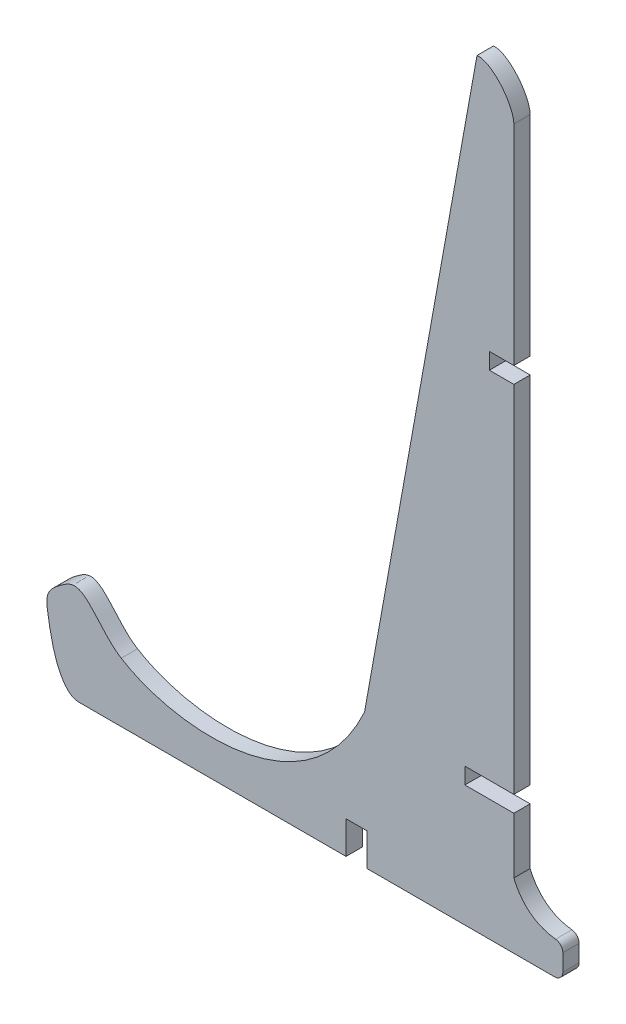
SolidWorks part; units mm, degrees
ref_plane "Plan de face" through (0, 0, 0) normal (0, 0, 1) x (1, 0, 0)
ref_plane "Plan de dessus" through (0, 0, 0) normal (0, 1, 0) x (1, 0, 0)
ref_plane "Plan de droite" through (0, 0, 0) normal (1, 0, 0) x (0, 0, -1)
sketch "Esquisse1" plane through (0, 0, 0) normal (0, 0, 1) x (1, 0, 0)
  line L0 (-5, 0) -> (-296.0946, 0)
  line L1 (-30, 40) -> (-30, 440)
  line L3 (0, 15.3047) -> (0, 5)
  line L6 (-121.4743, 82.2555) -> (-52.5746, 465.09)
  arc A0 (-296.0946, 0) -> (-303.118, 2.8816) centre (-296.0946, 10) cw
  arc A1 (-5, 0) -> (0, 5) centre (-5, 5) ccw
  arc A2 (-4.4219, 20.2711) -> (0, 15.3047) centre (-5, 15.3047) cw
  spline S0 degree 3 poles (-303.118, 2.8816) (-308.5789, 8.2696) (-312.4251, 20.4823) (-317.1679, 46.009) (-316.7603, 50.559) (-293.0095, 66.3483) (-282.4278, 43.3712) (-270.5103, 36.343) knots 0.041545 0.041545 0.041545 0.041545 0.264607 0.330646 0.660674 0.731734 1 1 1 1
  spline S1 degree 3 poles (-270.5103, 36.343) (-237.1219, 15.1792) (-155.3142, 8.3218) (-121.4743, 82.2555) knots 0 0 0 0 1 1 1 1
  spline S2 degree 3 poles (-52.5746, 465.09) (-43.2967, 466.2795) (-30.2, 449.9) (-30, 440) knots 0 0 0 0 1 1 1 1
  spline S3 degree 3 poles (-4.4219, 20.2711) (-16.2475, 21.6476) (-25.2007, 28.4801) (-30, 40) knots 0.107609 0.107609 0.107609 0.107609 1 1 1 1
  point P5 (-21.062, 27.4419)
  point P6 (-17.0408, 24.426)
  point P24 (0, 0)
  dimension "D2" = 10
  dimension "D5" = 5
  dimension "D1" = 5
  dimension "D3" = 30
extrude "Boss.-Extru.1" add sketch "Esquisse1" along normal blind 10
sketch "Esquisse2" plane through (0, 0, 10) normal (0, 0, 1) x (1, 0, 0)
  line L0 (-30, 40) -> (-30, 440) construction
  line L1 (-30, 84.3169) -> (-60, 84.3169)
  line L2 (-30, 84.3169) -> (-30, 74.3169)
  line L3 (-30, 74.3169) -> (-60, 74.3169)
  line L4 (-60, 84.3169) -> (-60, 74.3169)
  line L6 (-30, 311.8637) -> (-45, 311.8637)
  line L7 (-30, 311.8637) -> (-30, 301.8637)
  line L8 (-30, 301.8637) -> (-45, 301.8637)
  line L9 (-45, 311.8637) -> (-45, 301.8637)
  dimension "D1" = 30
  dimension "D2" = 10
  dimension "D3" = 15
  dimension "D4" = 10
extrude "Enlèv. mat.-Extru.1" cut sketch "Esquisse2" against normal blind 10
sketch "Esquisse3" plane through (0, 0, 10) normal (0, 0, 1) x (1, 0, 0)
  line L0 (-296.0946, 0) -> (-5, 0) construction
  line L1 (-132.8, 0) -> (-120, 0)
  line L2 (-132.8, 0) -> (-132.8, 20)
  line L3 (-132.8, 20) -> (-120, 20)
  line L4 (-120, 0) -> (-120, 20)
  line L5 (-30, 40) -> (-30, 74.3169) construction
  dimension "D1" = 12.8
  dimension "D2" = 20
  dimension "D3" = 90
extrude "Enlèv. mat.-Extru.2" cut sketch "Esquisse3" against normal blind 10
